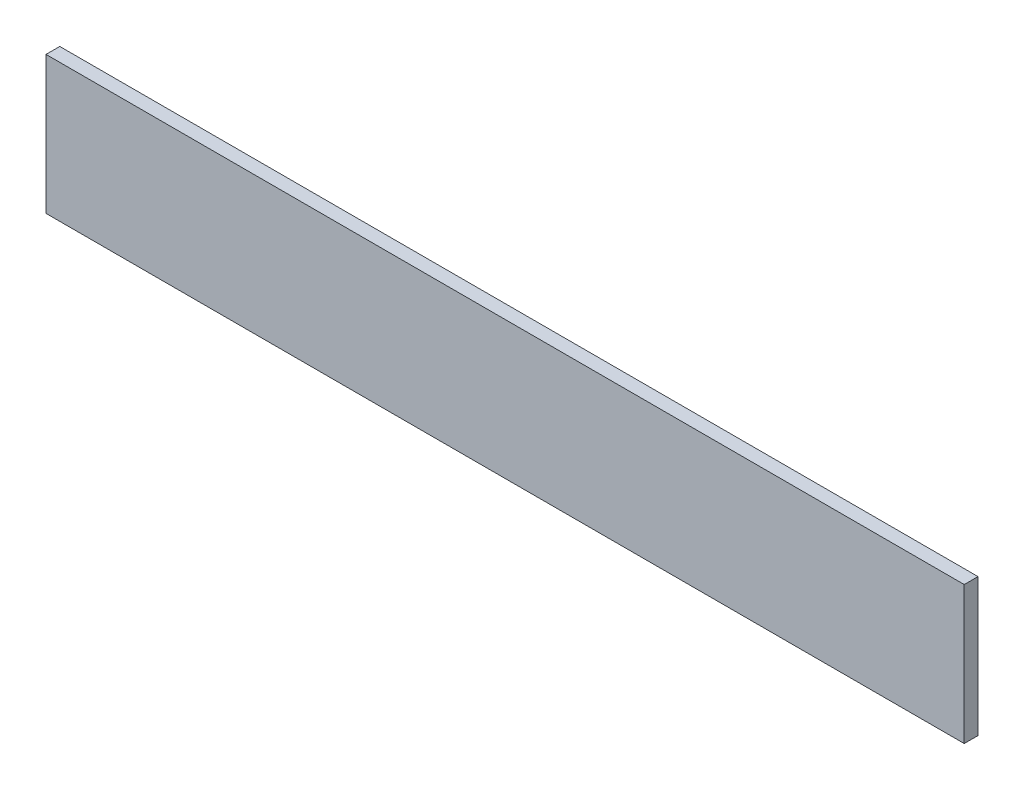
SolidWorks part; units mm, degrees
ref_plane "Face" through (0, 0, 0) normal (0, 0, 1) x (1, 0, 0)
ref_plane "Dessus" through (0, 0, 0) normal (0, 1, 0) x (1, 0, 0)
ref_plane "Profil" through (0, 0, 0) normal (1, 0, 0) x (0, 0, -1)
sketch "Esquisse1" plane through (0, 0, 0) normal (0, 0, 1) x (1, 0, 0)
  line L1 (0, 0) -> (80, 0)
  line L2 (0, 0) -> (0, 12)
  line L3 (0, 12) -> (80, 12)
  line L4 (80, 0) -> (80, 12)
  dimension "D1" = 80
  dimension "D2" = 12
extrude "Extrusion1" add sketch "Esquisse1" along normal mid plane 1.2
